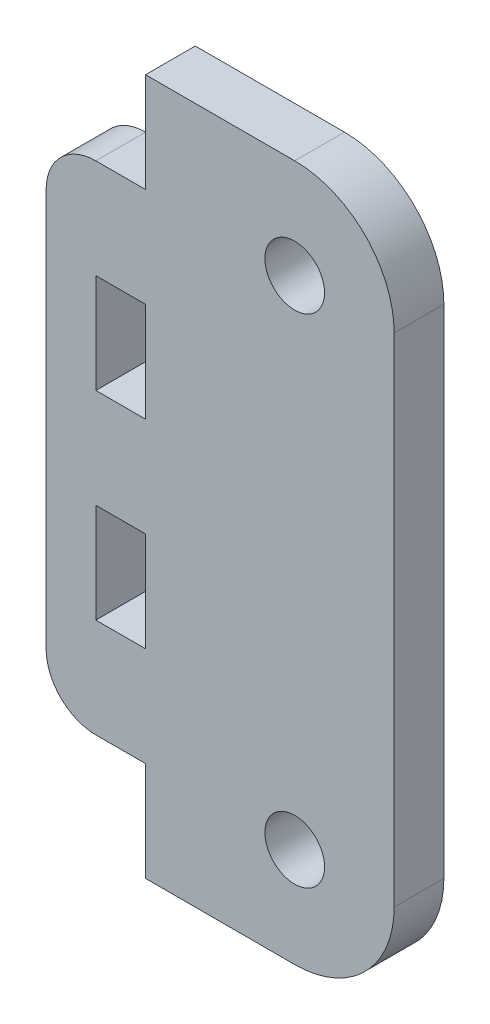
SolidWorks part; units mm, degrees
ref_plane "Plan de face" through (0, 0, 0) normal (0, 0, 1) x (1, 0, 0)
ref_plane "Plan de dessus" through (0, 0, 0) normal (0, 1, 0) x (1, 0, 0)
ref_plane "Plan de droite" through (0, 0, 0) normal (1, 0, 0) x (0, 0, -1)
sketch "Esquisse1" plane through (0, 0, 0) normal (0, 0, 1) x (1, 0, 0)
  line L1 (0, -35) -> (-30, -35)
  line L2 (0, -35) -> (0, 35)
  line L3 (0, 35) -> (-30, 35)
  line L4 (-30, -35) -> (-30, 35)
  dimension "D1" = 30
  dimension "D2" = 70
  dimension "D3" = 35
extrude "Boss.-Extru.1" add sketch "Esquisse1" along normal blind 5
sketch "Esquisse2" plane through (0, 0, 5) normal (0, 0, 1) x (1, 0, 0)
  line L1 (-15, 0) -> (-25, 0)
  line L2 (-15, 0) -> (-15, 5)
  line L3 (-15, 5) -> (-25, 5)
  line L4 (-25, 0) -> (-25, 5)
  dimension "D2" = 10
  dimension "D1" = 15
  dimension "D3" = 5
extrude "Enlèv. mat.-Extru.1" cut sketch "Esquisse2" against normal blind 5
sketch "Esquisse3" plane through (0, 0, 5) normal (0, 0, 1) x (1, 0, 0)
  line L0 (0, -35) -> (0, 35) construction
  line L1 (0, -35) -> (-5, -35)
  line L2 (0, -35) -> (0, -25)
  line L3 (0, -25) -> (-5, -25)
  line L4 (-5, -35) -> (-5, -25)
  line L5 (0, -5) -> (-5, -5)
  line L6 (0, -15) -> (0, -5)
  line L7 (0, -15) -> (-5, -15)
  line L8 (-5, -15) -> (-5, -5)
  line L9 (0, 15) -> (-5, 15)
  line L10 (0, 5) -> (0, 15)
  line L11 (0, 5) -> (-5, 5)
  line L12 (-5, 5) -> (-5, 15)
  line L13 (0, 35) -> (-5, 35)
  line L14 (0, 25) -> (0, 35)
  line L15 (0, 25) -> (-5, 25)
  line L16 (-5, 25) -> (-5, 35)
  dimension "D1" = 5
  dimension "D2" = 10
  dimension "D3" = 25
  dimension "D4" = 4
extrude "Enlèv. mat.-Extru.2" cut sketch "Esquisse3" against normal blind 10
sketch "Esquisse4" plane through (0, 0, 0) normal (1, 0, 0) x (0, 0, -1)
  line L1 (-5, 35) -> (0, 35)
  line L2 (-5, 35) -> (-5, -35)
  line L3 (-5, -35) -> (0, -35)
  line L4 (0, 35) -> (0, -35)
extrude "Boss.-Extru.2" add sketch "Esquisse4" along normal blind 25
sketch "Esquisse5" plane through (0, 0, 5) normal (0, 0, 1) x (1, 0, 0)
  line L0 (0, 35) -> (0, 25) construction
  line L1 (25, 35) -> (0, 35) construction
  line L2 (15, 25) -> (15, -25) construction
  line L3 (25, -35) -> (0, -35) construction
  line L4 (0, -25) -> (0, -35) construction
  circle A0 centre (15, 25) radius 3
  circle A1 centre (15, -25) radius 3
  dimension "D4" = 6
  dimension "D5" = 6
  dimension "D6" = 15
  dimension "D1" = 15
  dimension "D2" = 10
  dimension "D3" = 10
extrude "Enlèv. mat.-Extru.3" cut sketch "Esquisse5" against normal blind 5
fillet "Congé1" radius 10 2 edges at (25, 35, 2.5) (25, -35, 2.5)
sketch "Esquisse6" plane through (0, 0, 5) normal (0, 0, 1) x (1, 0, 0)
  line L0 (-5, 35) -> (-30, 35) construction
  line L1 (-30, -35) -> (-10, -35)
  line L2 (-30, -35) -> (-30, 35)
  line L3 (-30, 35) -> (-10, 35)
  line L4 (-10, -25) -> (-10, 25)
  line L5 (-5, -25) -> (-5, -35) construction
  line L7 (-5, -25) -> (-10, -25)
  line L8 (-5, -25) -> (-5, -35)
  line L9 (-5, -35) -> (-10, -35)
  line L11 (-5, 25) -> (-10, 25)
  line L12 (-5, 25) -> (-5, 35)
  line L13 (-5, 35) -> (-10, 35)
  dimension "D1" = 5
extrude "Enlèv. mat.-Extru.4" cut sketch "Esquisse6" against normal blind 10
fillet "Congé2" radius 5 2 edges at (-10, 25, 2.5) (-10, -25, 2.5)
